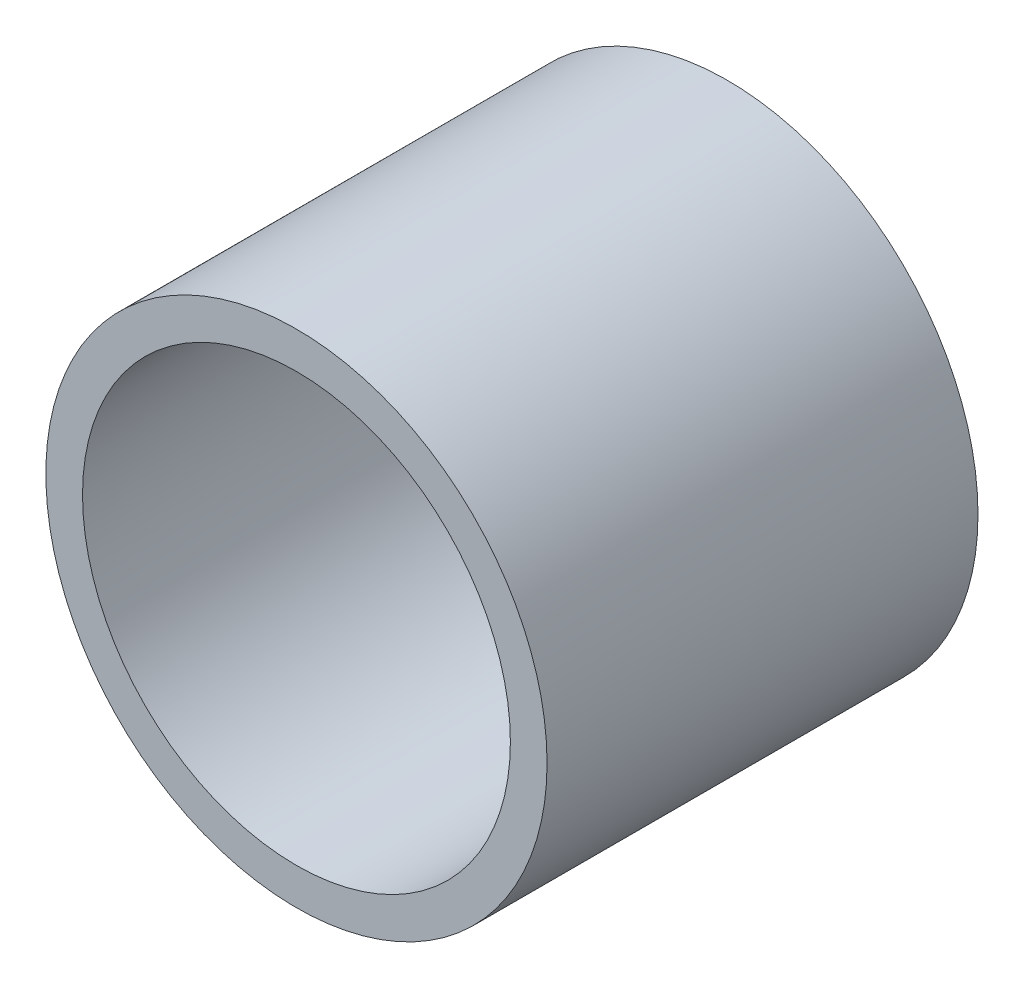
SolidWorks part; units mm, degrees
ref_plane "Alzado" through (0, 0, 0) normal (0, 0, 1) x (1, 0, 0)
ref_plane "Planta" through (0, 0, 0) normal (0, 1, 0) x (1, 0, 0)
ref_plane "Vista lateral" through (0, 0, 0) normal (1, 0, 0) x (0, 0, -1)
sketch "Croquis1" plane through (0, 0, 0) normal (0, 0, 1) x (1, 0, 0)
  circle A0 centre (0, 0) radius 41
  circle A1 centre (0, 0) radius 35
  dimension "D1" = 82
  dimension "D2" = 70
extrude "Saliente-Extruir1" add sketch "Croquis1" along normal blind 70.5
